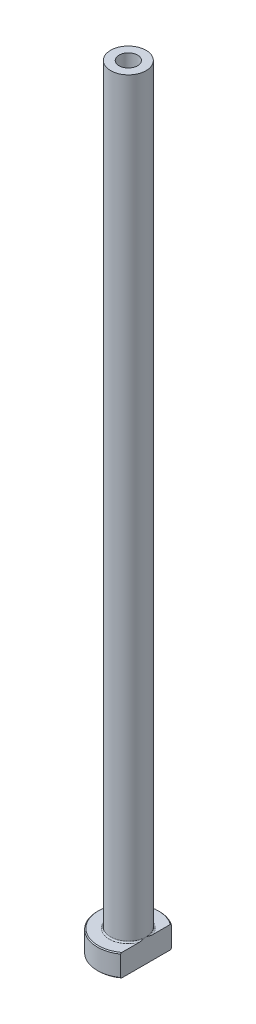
SolidWorks part; units mm, degrees
ref_plane "Front Plane" through (0, 0, 0) normal (0, 0, 1) x (1, 0, 0)
ref_plane "Top Plane" through (0, 0, 0) normal (0, 1, 0) x (1, 0, 0)
ref_plane "Right Plane" through (0, 0, 0) normal (1, 0, 0) x (0, 0, -1)
sketch "Sketch1" plane through (0, 0, 0) normal (0, 0, 1) x (1, 0, 0)
  line L0 (-2.1, 175) -> (-4, 175)
  line L1 (-4, 175) -> (-4, 5)
  line L2 (-4, 5) -> (-7, 5)
  line L3 (-7, 5) -> (-7, 0)
  line L4 (6.05, 0) -> (-6.05, 0) construction
  line L5 (-7, 0) -> (-2.35, 0)
  line L6 (-2.1, 130) -> (-2.1, 175)
  line L7 (0, 92.1877) -> (0, -15.5353) construction
  line L8 (0, -7.7) -> (0, 7.7) construction
  line L9 (-2.1, 130) -> (-2.35, 118)
  line L10 (-2.35, 118) -> (-2.35, 0)
  dimension "D1" = 0.25
  dimension "ID" = 4.2
  dimension "OD" = 8
  dimension "L" = 175
  dimension "H" = 14
  dimension "T" = 5
  dimension "N" = 45
  dimension "D2" = 12
  dimension "L-N" = 130
revolve "Revolve1" add sketch "Sketch1" angle 360 about L7
fillet "Fillet1" radius 0.3 1 edges at (0, 5, 4)
chamfer "Chamfer1" distance 0.2 angle 45 2 edges at (0, 5, 7) (0, 0, 7)
sketch "Sketch2" plane through (0, 0, 0) normal (0, -1, 0) x (1, 0, 0)
  line L0 (4, 5.7446) -> (4, -5.7446)
  circle A0 centre (0, 0) radius 7 construction
  arc A1 (4, 5.7446) -> (4, -5.7446) centre (0, 0) cw
  circle A2 centre (0, 0) radius 4 construction
extrude "Cut-Extrude1" cut sketch "Sketch2" against normal through all
chamfer "Chamfer2" distance 0.5 angle 45 1 edges at (0, 0, 2.35)
